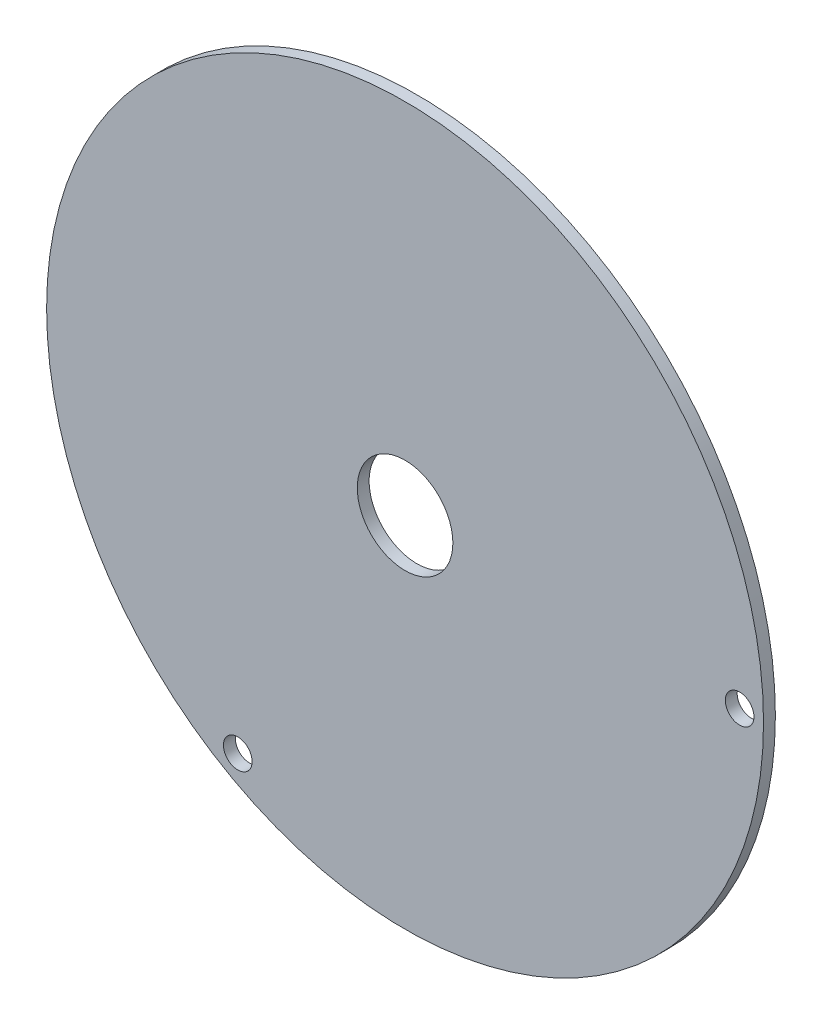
SolidWorks part; units mm, degrees
ref_plane "Plane1" through (0, 0, 0) normal (0, 0, 1) x (1, 0, 0)
ref_plane "Plane2" through (0, 0, 0) normal (0, 1, 0) x (1, 0, 0)
ref_plane "Plane3" through (0, 0, 0) normal (1, 0, 0) x (0, 0, -1)
sketch "Sketch1" plane through (0, 0, 0) normal (0, 0, 1) x (1, 0, 0)
  circle A0 centre (0, 0) radius 47.625
  dimension "D1" = 95.25
extrude "Base-Extrude" add sketch "Sketch1" along normal blind 1.5748
sketch "Sketch2" plane through (0, 0, 1.5748) normal (0, 0, 1) x (1, 0, 0)
  line L0 (0, 0) -> (44.45, 0) construction
  circle A0 centre (44.45, 0) radius 1.905
  circle A1 centre (-22.225, -38.4948) radius 1.905
  circle A2 centre (0, 0) radius 6.35
  dimension "D1" = 3.81
  dimension "D3" = 12.7
  dimension "D2" = 44.45
extrude "Cut-Extrude1" cut sketch "Sketch2" against normal through all
